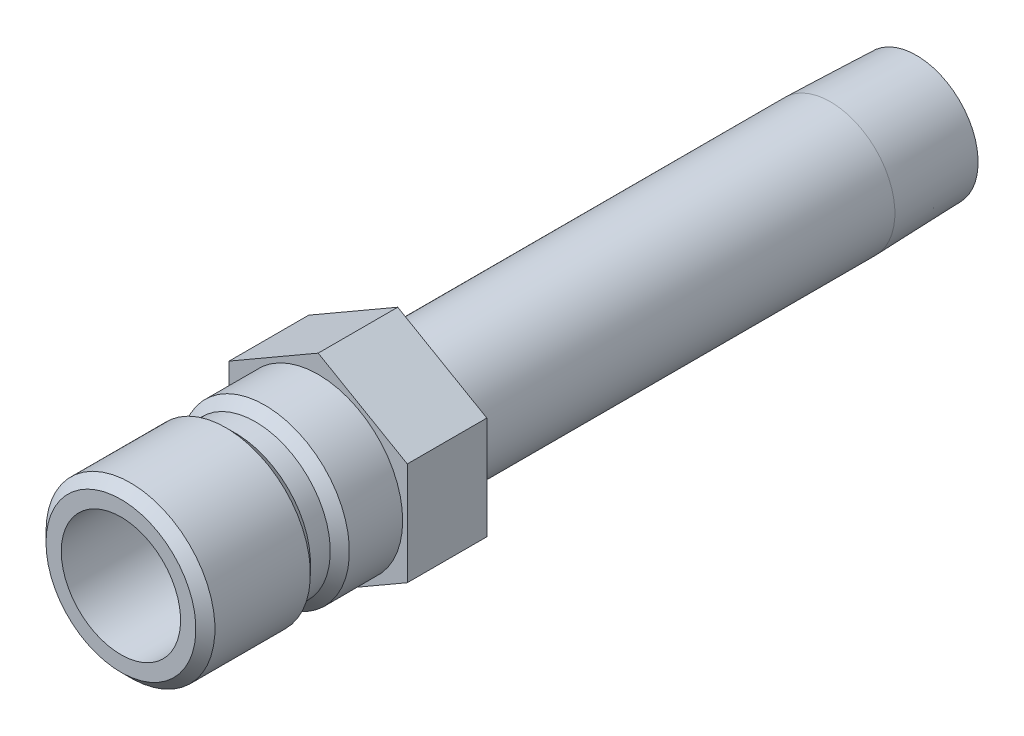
SolidWorks part; units mm, degrees
ref_plane "Front Plane" through (0, 0, 0) normal (0, 0, 1) x (1, 0, 0)
ref_plane "Top Plane" through (0, 0, 0) normal (0, 1, 0) x (1, 0, 0)
ref_plane "Right Plane" through (0, 0, 0) normal (1, 0, 0) x (0, 0, -1)
sketch "Sketch1" plane through (0, 0, 0) normal (1, 0, 0) x (0, 0, -1)
  line L0 (6.35, 0) -> (-18.923, 0) construction
  line L1 (-15.748, 4.7625) -> (-15.748, 5.9817)
  line L2 (-6.604, 5.9817) -> (-6.604, 0) construction
  line L3 (-14.986, 6.7437) -> (-7.366, 6.7437)
  line L4 (6.35, 5.1435) -> (6.35, 0) construction
  line L5 (-6.604, 5.9817) -> (-5.0165, 5.9817)
  line L6 (-4.2545, 6.7437) -> (6.35, 6.7437)
  line L7 (6.35, 6.7437) -> (6.35, 5.1435)
  line L8 (-6.604, 5.9817) -> (-7.366, 6.7437)
  line L9 (-5.0165, 5.9817) -> (-4.2545, 6.7437)
  line L10 (-15.748, 5.9817) -> (-14.986, 6.7437)
  line L11 (-15.748, 4.7625) -> (-3.556, 4.7625)
  line L12 (6.35, 5.1435) -> (40.894, 5.1435)
  line L13 (40.894, 5.1435) -> (47.752, 4.9292)
  line L14 (47.752, 4.9292) -> (47.752, 3.4163)
  line L15 (0, 0) -> (0, 6.7437) construction
  line L16 (6.35, 6.731) -> (6.35, 0) construction
  line L17 (-3.556, 4.7625) -> (-2.8402, 3.4163)
  line L19 (-2.8402, 3.4163) -> (47.752, 3.4163)
  dimension "D2" = 1.5875
  dimension "D3" = 0.762
  dimension "D4" = 45
  dimension "D5" = 9.144
  dimension "D6" = 45
  dimension "D7" = 1.79
  dimension "D8" = 6.858
  dimension "D9" = 63.5
  dimension "D10" = 3.175
  dimension "D11" = 9.525
  dimension "D12" = 10.287
  dimension "D13" = 22.098
  dimension "D14" = 13.4874
  dimension "D15" = 6.8326
  dimension "D16" = 12.192
  dimension "D17" = 6.35
  dimension "D18" = 118
revolve "Revolve1" add sketch "Sketch1" angle 360 about L0
sketch "Sketch2" plane through (0, 0, 0) normal (0, 0, 1) x (1, 0, 0)
  line L1 (-7.112, 4.1061) -> (-7.112, -4.1061)
  line L2 (-7.112, -4.1061) -> (0, -8.2122)
  line L3 (0, -8.2122) -> (7.112, -4.1061)
  line L4 (7.112, -4.1061) -> (7.112, 4.1061)
  line L5 (7.112, 4.1061) -> (0, 8.2122)
  line L6 (0, 8.2122) -> (-7.112, 4.1061)
  circle A0 centre (0, 0) radius 7.112 construction
  circle A1 centre (0, 0) radius 4.7625 construction
  circle A2 centre (0, 0) radius 4.7625
  dimension "D1" = 14.224
extrude "Boss-Extrude1" add sketch "Sketch2" against normal up to vertex (6.35 mm away)
